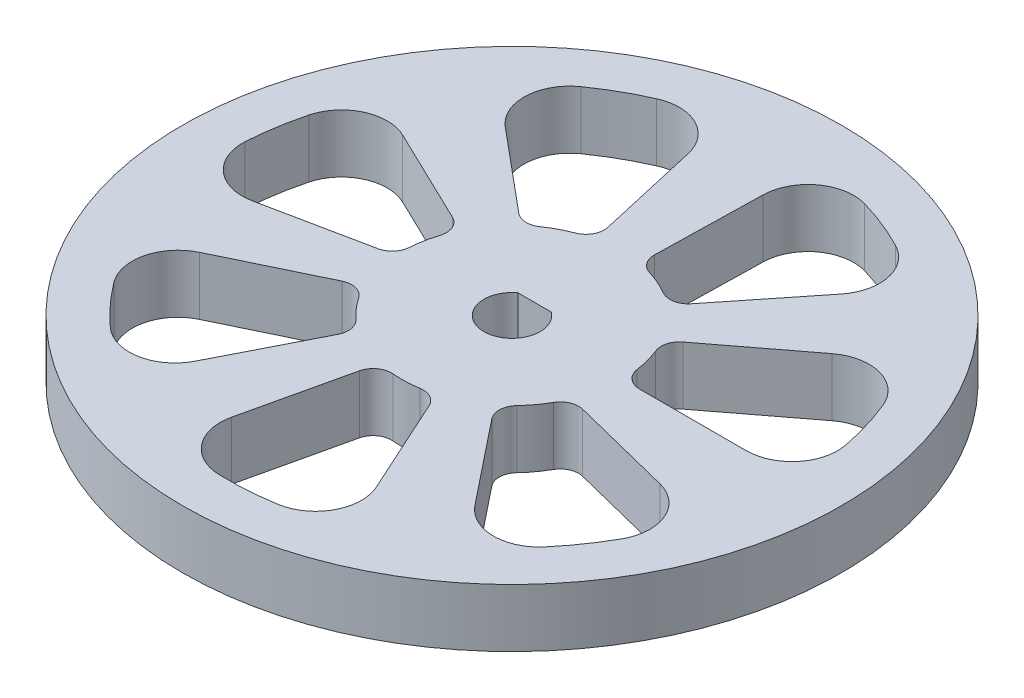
SolidWorks part; units mm, degrees
ref_plane "Front Plane" through (0, 0, 0) normal (0, 0, 1) x (1, 0, 0)
ref_plane "Top Plane" through (0, 0, 0) normal (0, 1, 0) x (1, 0, 0)
ref_plane "Right Plane" through (0, 0, 0) normal (1, 0, 0) x (0, 0, -1)
sketch "Sketch1" plane through (0, 0, 0) normal (0, 1, 0) x (1, 0, 0)
  line L0 (8.6834, -10.8887) -> (15.9526, -20.004)
  line L1 (12.7213, -5.0102) -> (23.9907, -7.8431)
  line L2 (13.9271, 0) -> (25.586, 0)
  line L3 (11.8488, 6.8221) -> (21.0899, 13.8666)
  line L4 (1.8319, 2.4636) -> (-1.8319, 2.4636)
  line L5 (-3.0991, -13.5779) -> (-5.6934, -24.9445)
  line L6 (4.0144, -13.0697) -> (8.826, -23.6468)
  line L7 (-12.5479, -6.0428) -> (-23.0522, -11.1014)
  line L8 (-7.7154, -11.2875) -> (-12.9849, -21.6439)
  line L9 (-12.5479, 6.0428) -> (-23.0522, 11.1014)
  line L10 (-13.6354, -1.0055) -> (-25.0179, -3.3428)
  line L11 (-3.0991, 13.5779) -> (-5.6934, 24.9445)
  line L12 (-9.2876, 10.0336) -> (-18.2119, 17.4756)
  line L13 (8.6834, 10.8887) -> (15.9526, 20.004)
  line L14 (2.0539, 13.5172) -> (2.308, 25.1345)
  circle A0 centre (0, 0) radius 36
  arc A1 (-1.8319, 2.4636) -> (1.8319, 2.4636) centre (0, 0) ccw
  arc A2 (30.4932, 5.959) -> (28.7474, 11.787) centre (0, 0) ccw
  arc A3 (11.9474, 1.7157) -> (11.2046, 4.4879) centre (0, 0) ccw
  arc A4 (25.586, 0) -> (30.4932, 5.959) centre (25.586, 5) ccw
  arc A5 (21.0899, 13.8666) -> (28.7474, 11.787) centre (24.1211, 9.8902) cw
  arc A6 (11.9474, 1.7157) -> (13.9271, 0) centre (13.9271, 2) ccw
  arc A7 (11.2046, 4.4879) -> (11.8488, 6.8221) centre (13.0612, 5.2315) cw
  arc A9 (23.6711, -20.1252) -> (27.1392, -15.1265) centre (0, 0) ccw
  arc A10 (8.7905, -8.2712) -> (10.4947, -5.962) centre (0, 0) ccw
  arc A11 (15.9526, -20.004) -> (23.6711, -20.1252) centre (19.8618, -16.8865) ccw
  arc A12 (23.9907, -7.8431) -> (27.1392, -15.1265) centre (22.7717, -12.6922) cw
  arc A13 (8.7905, -8.2712) -> (8.6834, -10.8887) centre (10.2471, -9.6417) ccw
  arc A14 (10.4947, -5.962) -> (12.7213, -5.0102) centre (12.2337, -6.9499) cw
  arc A15 (-0.9758, -31.0547) -> (5.0946, -30.6495) centre (0, 0) ccw
  arc A16 (-0.9859, -12.0297) -> (1.8821, -11.9224) centre (0, 0) ccw
  arc A17 (-5.6934, -24.9445) -> (-0.9758, -31.0547) centre (-0.8188, -26.0571) ccw
  arc A18 (8.826, -23.6468) -> (5.0946, -30.6495) centre (4.2747, -25.7171) cw
  arc A19 (-0.9859, -12.0297) -> (-3.0991, -13.5779) centre (-1.1492, -14.023) ccw
  arc A20 (1.8821, -11.9224) -> (4.0144, -13.0697) centre (2.1939, -13.8979) cw
  arc A21 (-24.8879, -18.5993) -> (-20.7863, -23.0928) centre (0, 0) ccw
  arc A22 (-10.0199, -6.7296) -> (-8.1478, -8.9049) centre (0, 0) ccw
  arc A23 (-23.0522, -11.1014) -> (-24.8879, -18.5993) centre (-20.8828, -15.6062) ccw
  arc A24 (-12.9849, -21.6439) -> (-20.7863, -23.0928) centre (-17.4412, -19.3765) cw
  arc A25 (-10.0199, -6.7296) -> (-12.5479, -6.0428) centre (-11.6801, -7.8447) ccw
  arc A26 (-8.1478, -8.9049) -> (-7.7154, -11.2875) centre (-9.4979, -10.3805) cw
  arc A27 (-30.0589, 7.8617) -> (-31.0147, 1.8533) centre (0, 0) ccw
  arc A28 (-11.5087, 3.638) -> (-12.0422, 0.8181) centre (0, 0) ccw
  arc A29 (-23.0522, 11.1014) -> (-30.0589, 7.8617) centre (-25.2216, 6.5965) ccw
  arc A30 (-25.0179, -3.3428) -> (-31.0147, 1.8533) centre (-26.0236, 1.555) cw
  arc A31 (-11.5087, 3.638) -> (-12.5479, 6.0428) centre (-13.4157, 4.2408) ccw
  arc A32 (-12.0422, 0.8181) -> (-13.6354, -1.0055) centre (-14.0376, 0.9536) cw
  arc A33 (-12.5949, 28.4027) -> (-17.8884, 25.4038) centre (0, 0) ccw
  arc A34 (-4.3312, 11.2661) -> (-6.8686, 9.9251) centre (0, 0) ccw
  arc A35 (-5.6934, 24.9445) -> (-12.5949, 28.4027) centre (-10.5681, 23.8319) ccw
  arc A36 (-18.2119, 17.4756) -> (-17.8884, 25.4038) centre (-15.0097, 21.3156) cw
  arc A37 (-4.3312, 11.2661) -> (-3.0991, 13.5779) centre (-5.0489, 13.1329) ccw
  arc A38 (-6.8686, 9.9251) -> (-9.2876, 10.0336) centre (-8.0067, 11.5697) cw
  arc A39 (14.3533, 27.5559) -> (8.7082, 29.8247) centre (0, 0) ccw
  arc A40 (6.1077, 10.4106) -> (3.4772, 11.5583) centre (0, 0) ccw
  arc A41 (15.9526, 20.004) -> (14.3533, 27.5559) centre (12.0435, 23.1214) ccw
  arc A42 (2.308, 25.1345) -> (8.7082, 29.8247) centre (7.3068, 25.0251) cw
  arc A43 (6.1077, 10.4106) -> (8.6834, 10.8887) centre (7.1198, 12.1356) ccw
  arc A44 (3.4772, 11.5583) -> (2.0539, 13.5172) centre (4.0534, 13.4735) cw
  point P7 (31.07, 0)
  dimension "D1" = 5
  dimension "D2" = 2
  dimension "D3" = 28
  dimension "D4" = 9
  dimension "D5" = 72
extrude "Extrude1" add sketch "Sketch1" along normal blind 6.35
